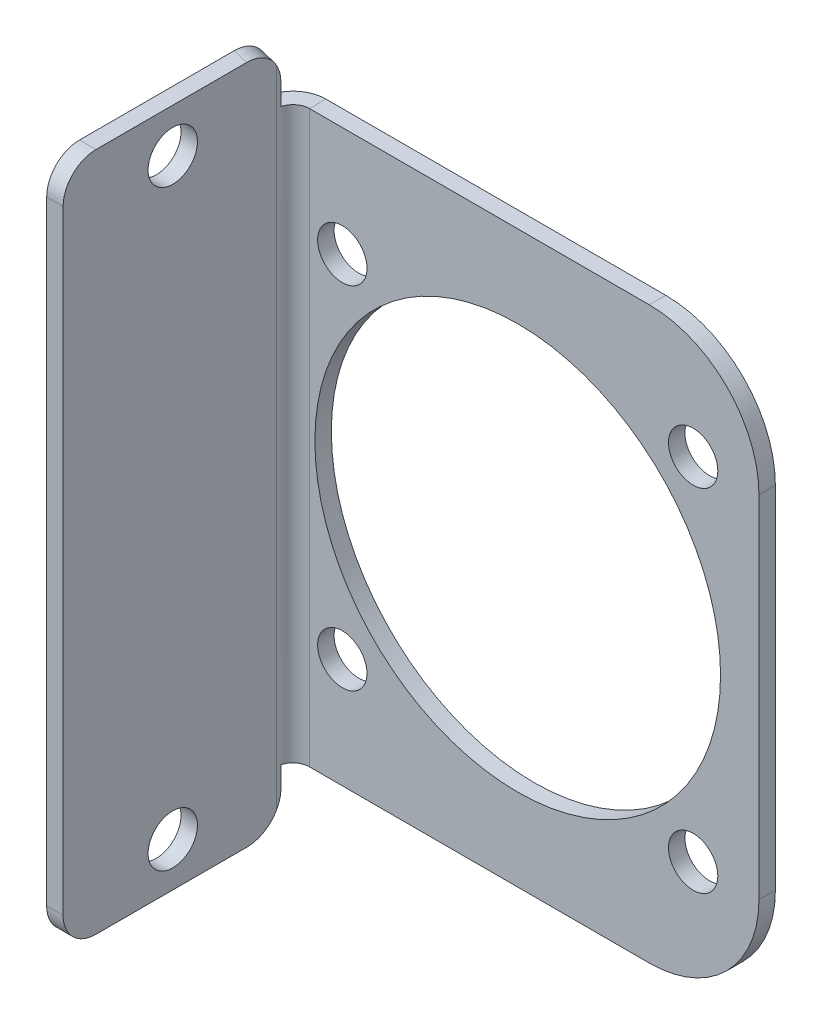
SolidWorks part; units mm, degrees
ref_plane "Přední rovina" through (0, 0, 0) normal (0, 0, 1) x (1, 0, 0)
ref_plane "Horní rovina" through (0, 0, 0) normal (0, 1, 0) x (1, 0, 0)
ref_plane "Pravá rovina" through (0, 0, 0) normal (1, 0, 0) x (0, 0, -1)
sketch "Skica1" plane through (0, 0, 0) normal (0, 0, 1) x (1, 0, 0)
  line L0 (-3.8943, 37.701) -> (-23.8943, 37.701)
  line L1 (-23.8943, 37.701) -> (-23.8998, -24.299)
  line L2 (-23.8998, -24.299) -> (-3.9002, -24.299)
  line L3 (-3.9002, -24.299) -> (-3.9002, -19.299)
  line L4 (-3.9002, -19.299) -> (40.1057, -19.299)
  line L5 (40.1057, -19.299) -> (40.1057, 32.701)
  line L6 (40.1057, 32.701) -> (-3.8943, 32.701)
  line L7 (-3.8943, 32.701) -> (-3.8943, 37.701)
  line L8 (18.1057, 32.701) -> (18.1027, -19.299) construction
  line L9 (40.1057, 6.701) -> (-23.8943, 6.701) construction
  line L10 (-13.8943, 37.701) -> (-13.8943, -24.299) construction
  line L12 (34.1042, 22.701) -> (2.1042, 22.701) construction
  line L13 (34.1042, 22.701) -> (34.1042, -9.299) construction
  line L14 (34.1042, -9.299) -> (2.1042, -9.299) construction
  line L15 (2.1042, 22.701) -> (2.1042, -9.299) construction
  line L16 (34.1042, 22.701) -> (2.1042, -9.299) construction
  line L17 (34.1042, -9.299) -> (2.1042, 22.701) construction
  circle A0 centre (18.1042, 6.701) radius 18.5
  circle A1 centre (-13.8943, 33.701) radius 2.25
  circle A2 centre (-13.8943, -20.299) radius 2.25
  circle A3 centre (34.1042, 22.701) radius 2.25
  circle A4 centre (2.1042, 22.701) radius 2.25
  circle A5 centre (2.1042, -9.299) radius 2.25
  circle A6 centre (34.1042, -9.299) radius 2.25
  point P28 (18.1042, 6.701)
  dimension "D6" = 4
  dimension "D8" = 4.5
  dimension "D9" = 4.5
  dimension "D10" = 37
  dimension "D11" = 4.5
  dimension "D1" = 20
  dimension "D2" = 62
  dimension "D3" = 52
  dimension "D4" = 44
  dimension "D5" = 5
  dimension "D7" = 4
  dimension "D18" = 32
  dimension "D19" = 32
sheet metal parameters "Plechový díl1" thickness 1.5 parameters "D1"=1
base flange "Základní plech1" sketch "Skica1" thickness 1.5 reverse thickness direction no parameters "D1"=1
sketch "Skica6" plane through (0, 0, 0) normal (0, 0, 1) x (1, 0, 0)
  line L0 (-3.8943, 32.701) -> (-3.9002, -19.299)
sketched bend "Ohyb ze skici7" parameters "D1"=1.5
bend "Ohyb ze skici8" bend radius 1.5 bend angle 90 parameters "D5"=1
fillet "Zaoblit1" radius 10 1 edges at (40.1057, 32.701, -0.75)
fillet "Zaoblit2" radius 10 1 edges at (40.1057, -19.299, -0.75)
fillet "Zaoblit3" radius 3 7 edges
fillet "Zaoblit4" radius 3 1 edges at (-3.1508, -24.3014, 20.9647)
fillet "Zaoblit5" radius 3 1 edges at (-3.1437, 37.6986, 20.9663)
fillet "Zaoblit6" radius 3 7 edges
flat pattern "Rozvinutý tvar1"
sketch "Čáry ohybu1" plane through (0, 0, 0) normal (0, 0, 1) x (1, 0, 0)
  line L0 (-2.7687, 32.701) -> (-2.7747, -19.299) construction
  line L1 (-2.7687, 32.701) -> (-2.7747, -19.299) construction
sketch3d "Vymezovací rámeček1" [suppressed]
  line L0 (-23.8943, 37.7025, 0) -> (40.107, 37.6968, 0) construction
  line L1 (-23.8998, -24.2975, 0) -> (40.1016, -24.3032, 0) construction
  line L2 (-23.8943, 37.7025, 0) -> (-23.8998, -24.2975, 0) construction
  line L3 (40.107, 37.6968, 0) -> (40.1016, -24.3032, 0) construction
bend of the flat pattern "Rozvinutí-<Ohyb ze skici8>1"
